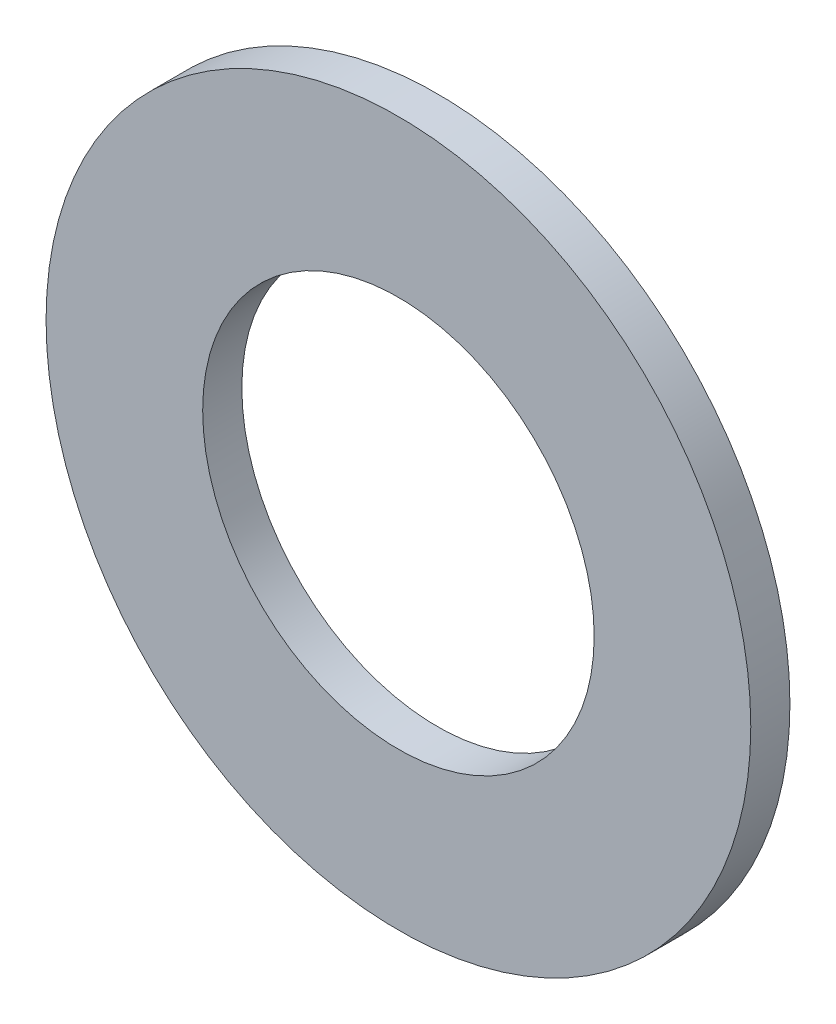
SolidWorks part; units mm, degrees
ref_plane "Plan1" through (0, 0, 0) normal (0, 0, 1) x (1, 0, 0)
ref_plane "Plan2" through (0, 0, 0) normal (0, 1, 0) x (1, 0, 0)
ref_plane "Plan3" through (0, 0, 0) normal (1, 0, 0) x (0, 0, -1)
sketch "Esquisse1" plane through (0, 0, 0) normal (0, 0, 1) x (1, 0, 0)
  circle A0 centre (0, 0) radius 18
  dimension "D1" = 36
extrude "Base-Extrusion" add sketch "Esquisse1" along normal blind 2
sketch "Esquisse2" plane through (0, 0, 2) normal (0, 0, 1) x (1, 0, 0)
  circle A0 centre (0, 0) radius 10
  dimension "D1" = 20
extrude "Enlèv. mat.-Extru.1" cut sketch "Esquisse2" against normal blind 2
